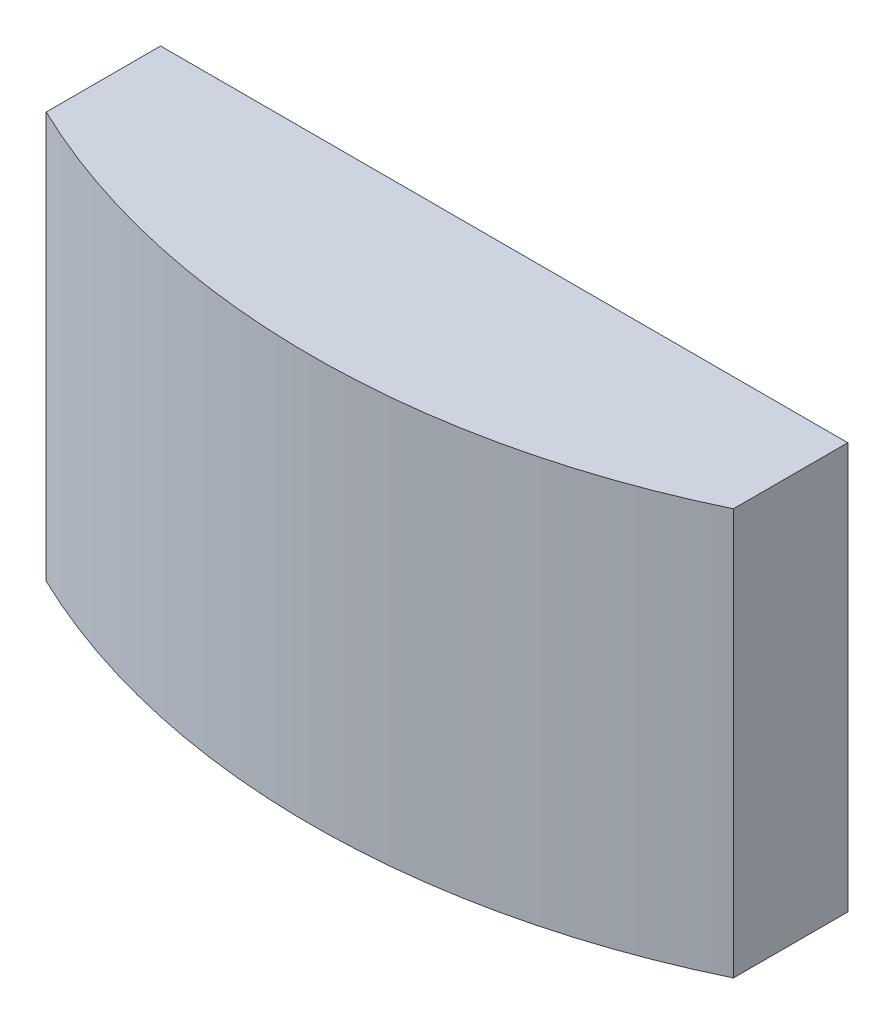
SolidWorks part; units mm, degrees
ref_plane "Front Plane" through (0, 0, 0) normal (0, 0, 1) x (1, 0, 0)
ref_plane "Top Plane" through (0, 0, 0) normal (0, 1, 0) x (1, 0, 0)
ref_plane "Right Plane" through (0, 0, 0) normal (1, 0, 0) x (0, 0, -1)
sketch "Sketch2" plane through (0, 0, 0) normal (0, 1, 0) x (1, 0, 0)
  line L0 (-76.5655, 0) -> (76.5655, 0)
  line L1 (76.5655, 0) -> (76.5655, -25.4871)
  line L2 (-76.5655, 0) -> (-76.5655, -25.4871)
  arc A0 (-76.5655, -25.4871) -> (76.5655, -25.4871) centre (0, 133.4992) ccw
extrude "Extrude1" add sketch "Sketch2" along normal blind 90.548
ref_plane "Plane1" through (0, 0, 92.8275) normal (0, 0, 1) x (1, 0, 0)
sketch "Sketch3" plane through (0, 0, 92.8275) normal (0, 0, 1) x (1, 0, 0)
  circle A0 centre (0, 44.6691) radius 33.9644
  circle A1 centre (-18.7526, 44.6691) radius 6.9566
  circle A2 centre (18.4501, 44.6691) radius 6.9566
